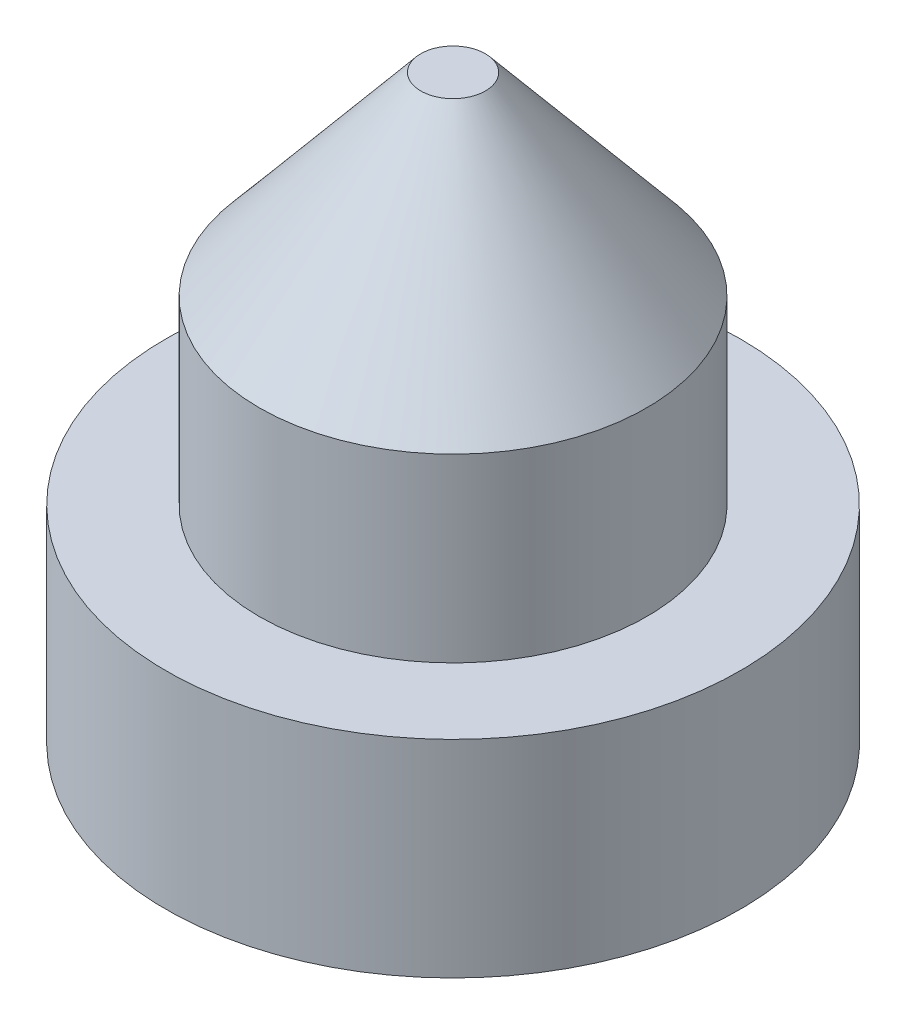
SolidWorks part; units mm, degrees
ref_plane "Plan de face" through (0, 0, 0) normal (0, 0, 1) x (1, 0, 0)
ref_plane "Plan de dessus" through (0, 0, 0) normal (0, 1, 0) x (1, 0, 0)
ref_plane "Plan de droite" through (0, 0, 0) normal (1, 0, 0) x (0, 0, -1)
sketch "Esquisse1" plane through (0, 0, 0) normal (0, 0, 1) x (1, 0, 0)
  line L0 (0, 0) -> (0, 33.0283) construction
  line L1 (2.225, 0) -> (2.225, 1.6)
  line L2 (2.225, 0) -> (0, 0)
  line L3 (2.225, 1.6) -> (1.5, 1.6)
  line L4 (1.5, 1.6) -> (1.5, 3)
  line L5 (0, 4.5) -> (0.25, 4.5)
  line L6 (0.25, 4.5) -> (1.5, 3)
  line L7 (0, 0) -> (0, 4.5)
  dimension "D1" = 4.45
  dimension "D2" = 1.6
  dimension "D3" = 3
  dimension "D4" = 3
  dimension "D5" = 4.5
  dimension "D6" = 0.25
revolve "Révolution1" add sketch "Esquisse1" angle 360 about L0
